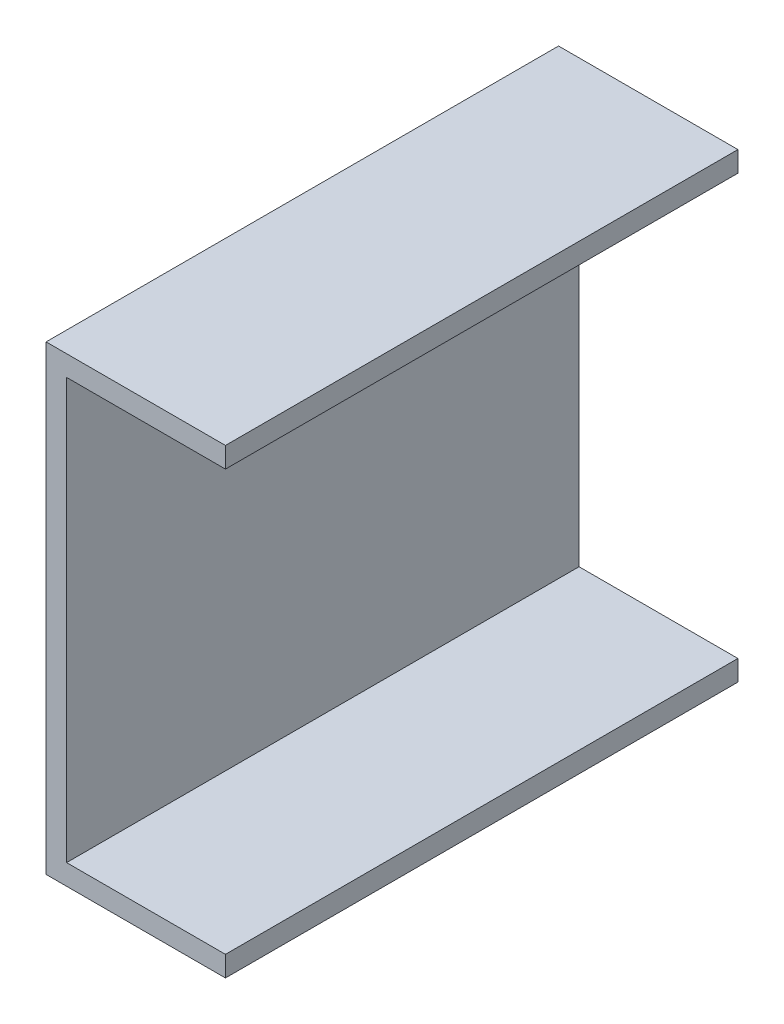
SolidWorks part; units mm, degrees
ref_plane "Vorne" through (0, 0, 0) normal (0, 0, 1) x (1, 0, 0)
ref_plane "Oben" through (0, 0, 0) normal (0, 1, 0) x (1, 0, 0)
ref_plane "Links" through (0, 0, 0) normal (1, 0, 0) x (0, 0, -1)
sketch "Skizze1" plane through (0, 0, 0) normal (0, 0, 1) x (1, 0, 0)
  line L0 (8, 8) -> (8, 172)
  line L1 (0, 0) -> (70, 0)
  line L2 (0, 0) -> (0, 180)
  line L3 (0, 180) -> (70, 180)
  line L4 (70, 0) -> (70, 8)
  line L5 (8, 172) -> (70, 172)
  line L6 (8, 172) -> (62, 172) construction
  line L7 (8, 8) -> (70, 8)
  line L8 (62, 8) -> (62, 172) construction
  line L9 (8, 8) -> (62, 8) construction
  line L10 (70, 172) -> (70, 180)
  line L11 (70, 0) -> (70, 180) construction
  dimension "D1" = 180
  dimension "D2" = 70
  dimension "D3" = 8
extrude "Linear austragen1" add sketch "Skizze1" along normal blind 200
